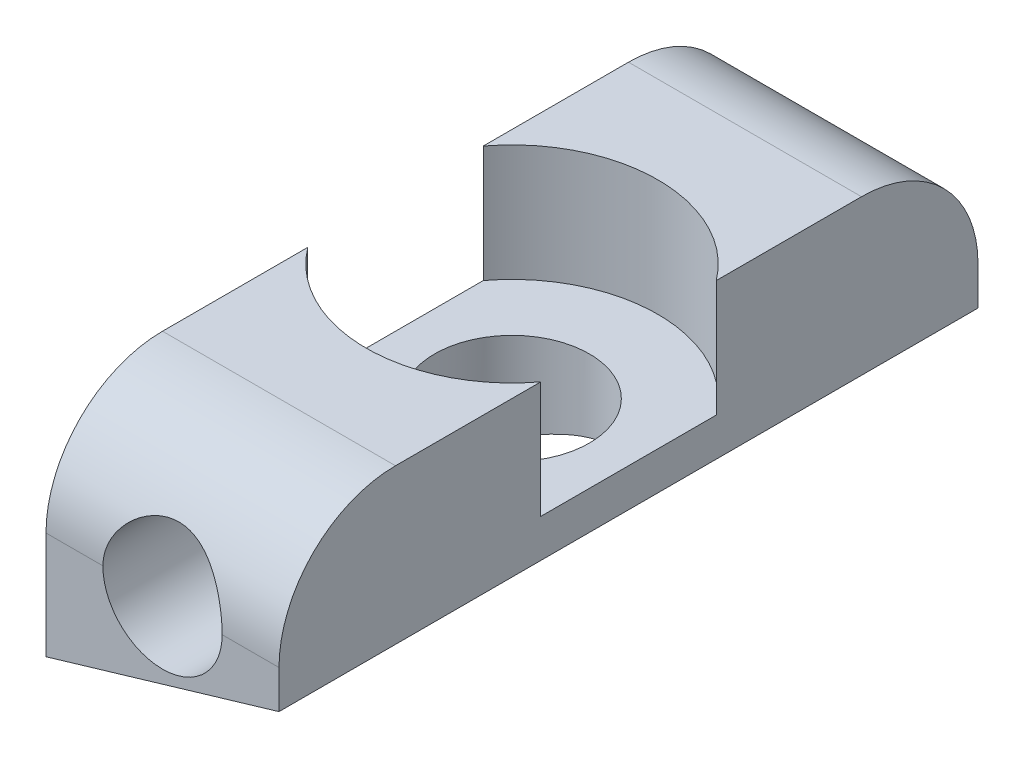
SolidWorks part; units mm, degrees
ref_plane "Plane1" through (0, 0, 0) normal (0, 0, 1) x (1, 0, 0)
ref_plane "Plane2" through (0, 0, 0) normal (0, 1, 0) x (1, 0, 0)
ref_plane "Plane3" through (0, 0, 0) normal (1, 0, 0) x (0, 0, -1)
sketch "Sketch1" plane through (0, 0, 0) normal (0, 0, 1) x (1, 0, 0)
  line L0 (-34.29, 98.9033) -> (-34.29, 94.6869)
  line L1 (-34.29, 94.6869) -> (-40.64, 92.8073)
  line L4 (-40.64, 92.8073) -> (-40.64, 98.9033)
  line L5 (-40.64, 98.9033) -> (-34.29, 98.9033)
  dimension "D1" = 6.096
  dimension "D2" = 4.2164
  dimension "D3" = 6.35
extrude "Base-Extrude" add sketch "Sketch1" along normal blind 19.05
fillet "leading_edge" radius 3.175
ref_plane "back_plane" through (0, 0, 19.05) normal (0, 0, 1) x (1, 0, 0)
fillet "aft_edge" radius 3.175
sketch "Sketch4" plane through (0, 98.9033, 0) normal (0, 1, 0) x (-1, 0, 0)
  line L0 (40.64, 0) -> (34.29, 0) construction
  circle A0 centre (37.465, 9.525) radius 2.1082
  dimension "D1" = 4.2164
  dimension "D2" = 9.525
  dimension "D3" = 3.175
extrude "thru" cut sketch "Sketch4" against normal through all
sketch "Sketch5" plane through (0, 98.9033, 0) normal (0, 1, 0) x (-1, 0, 0)
  circle A0 centre (37.465, 9.525) radius 3.9751
  dimension "D1" = 7.9502
extrude "cbore" cut sketch "Sketch5" against normal blind 3.175
sketch "Sketch3" plane through (0, 0, 19.05) normal (0, 0, 1) x (1, 0, 0)
  line L0 (-40.64, 98.9033) -> (-40.64, 95.7283) construction
  line L1 (-40.64, 98.9033) -> (-34.29, 98.9033) construction
  circle A1 centre (-37.465, 95.7283) radius 1.6256
  dimension "D1" = 3.2512
  dimension "D3" = 3.175
  dimension "D2" = 3.175
extrude "slot" cut sketch "Sketch3" against normal up to next
